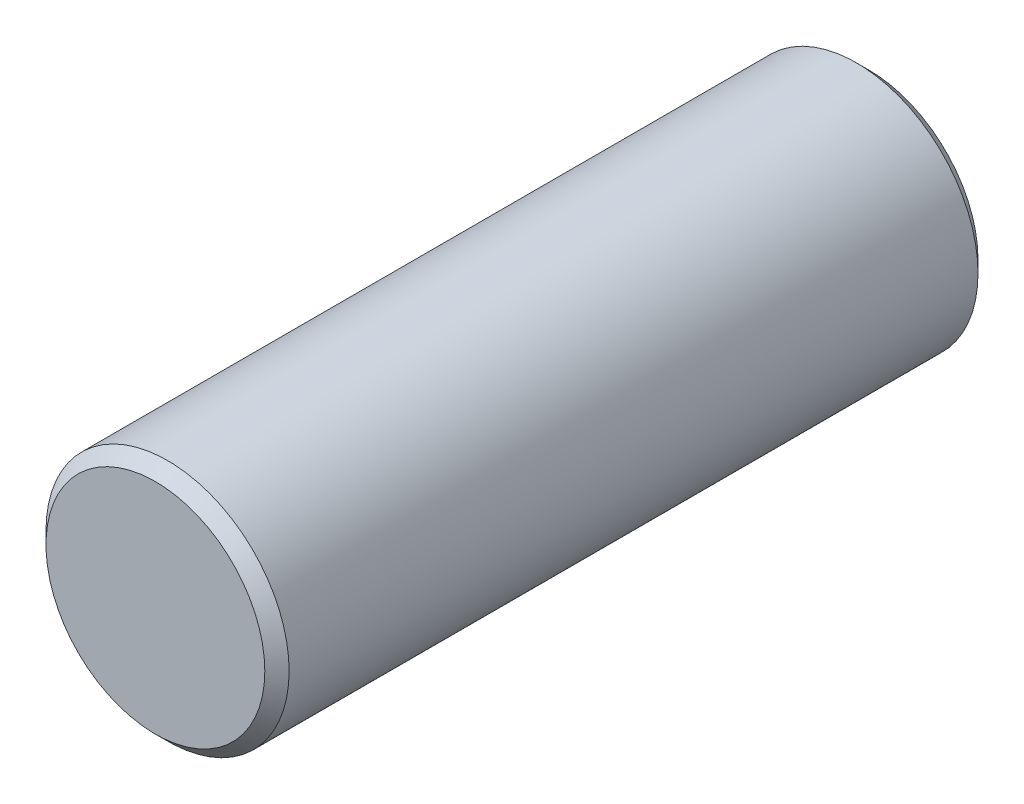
SolidWorks part; units mm, degrees
ref_plane "Plane1" through (0, 0, 0) normal (0, 0, 1) x (1, 0, 0)
ref_plane "Plane2" through (0, 0, 0) normal (0, 1, 0) x (1, 0, 0)
ref_plane "Plane3" through (0, 0, 0) normal (1, 0, 0) x (0, 0, -1)
sketch "Esquisse1" plane through (0, 0, 0) normal (0, 0, 1) x (1, 0, 0)
  circle A0 centre (0, 0) radius 15
  dimension "D1" = 30
extrude "Base-Extrusion" add sketch "Esquisse1" along normal blind 88
chamfer "Chanfrein1" distance 1.5 angle 45 2 edges at (15, 0, 0) (15, 0, 88)
